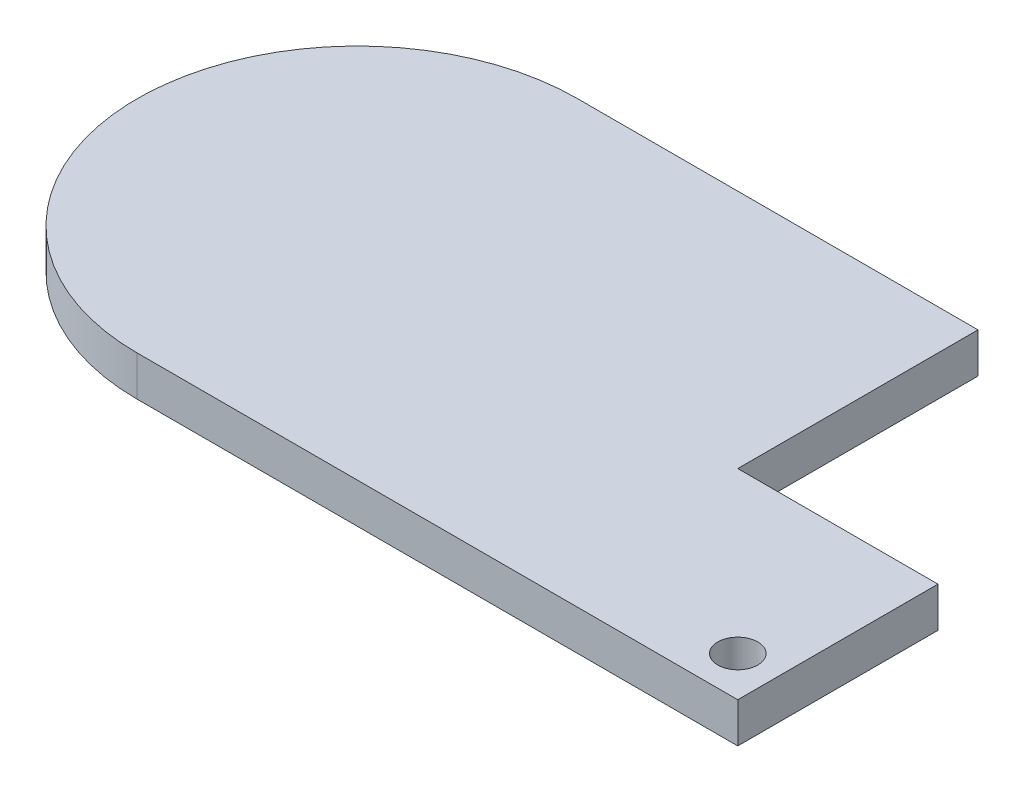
SolidWorks part; units mm, degrees
ref_plane "Front Plane" through (0, 0, 0) normal (0, 0, 1) x (1, 0, 0)
ref_plane "Top Plane" through (0, 0, 0) normal (0, 1, 0) x (1, 0, 0)
ref_plane "Right Plane" through (0, 0, 0) normal (1, 0, 0) x (0, 0, -1)
sketch "Sketch1" plane through (0, 0, 0) normal (0, 1, 0) x (1, 0, 0)
  line L0 (0, 0) -> (150, 0)
  line L1 (150, 0) -> (150, 50)
  line L2 (150, 50) -> (100, 50)
  line L3 (100, 50) -> (100, 110)
  line L4 (100, 110) -> (0, 110)
  arc A0 (0, 110) -> (0, 0) centre (0, 55) ccw
  dimension "D1" = 150
  dimension "D2" = 50
  dimension "D3" = 60
  dimension "D4" = 100
extrude "Extrude1" add sketch "Sketch1" along normal blind 10
sketch "Sketch2" plane through (0, 10, 0) normal (0, 1, 0) x (-1, 0, 0)
  line L0 (-150, 0) -> (-150, -50) construction
  line L1 (0, 0) -> (-150, 0) construction
  circle A0 centre (-140, -10) radius 5
  dimension "D1" = 10
  dimension "D2" = 10
  dimension "D3" = 10
extrude "Cut-Extrude1" cut sketch "Sketch2" against normal through all
